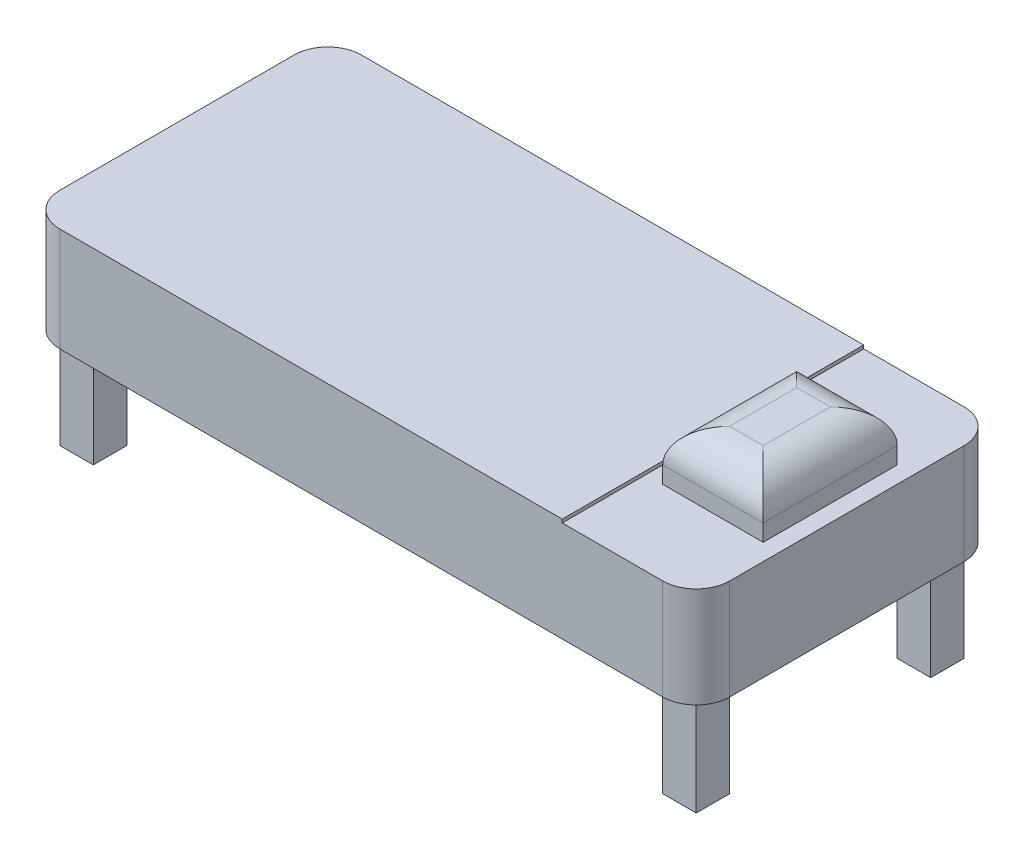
SolidWorks part; units mm, degrees
ref_plane "Plan de face" through (0, 0, 0) normal (0, 0, 1) x (1, 0, 0)
ref_plane "Plan de dessus" through (0, 0, 0) normal (0, 1, 0) x (1, 0, 0)
ref_plane "Plan de droite" through (0, 0, 0) normal (1, 0, 0) x (0, 0, -1)
sketch "Esquisse1" plane through (0, 0, 0) normal (0, 1, 0) x (1, 0, 0)
  line L1 (1000, -450) -> (-1000, -450)
  line L2 (1000, -450) -> (1000, 450)
  line L3 (1000, 450) -> (-1000, 450)
  line L4 (-1000, -450) -> (-1000, 450)
  line L5 (1000, -450) -> (-1000, 450) construction
  line L6 (1000, 450) -> (-1000, -450) construction
  point P0 (0, 0)
  dimension "D1" = 2000
  dimension "D2" = 900
extrude "Boss.-Extru.1" add sketch "Esquisse1" along normal blind 300
sketch "Esquisse2" plane through (0, 0, 0) normal (0, -1, 0) x (1, 0, 0)
  line L0 (-1000, 450) -> (1000, 450) construction
  line L1 (-950, 400) -> (-850, 400)
  line L2 (-950, 400) -> (-950, 300)
  line L3 (-950, 300) -> (-850, 300)
  line L4 (-850, 400) -> (-850, 300)
  line L5 (-950, 400) -> (-850, 300) construction
  line L6 (-950, 300) -> (-850, 400) construction
  line L7 (-1000, -450) -> (-1000, 450) construction
  point P0 (-900, 350)
  dimension "D1" = 100
  dimension "D2" = 100
  dimension "D3" = 50
  dimension "D4" = 50
extrude "Boss.-Extru.2" add sketch "Esquisse2" along normal blind 300
mirror "Symétrie1" about plane through (0, 0, 0) normal (0, 0, 1) of "Boss.-Extru.2"
mirror "Symétrie2" about plane through (0, 0, 0) normal (1, 0, 0) of "Symétrie1", "Boss.-Extru.2"
sketch "Esquisse3" plane through (0, 300, 0) normal (0, 1, 0) x (1, 0, 0)
  line L0 (-1000, -450) -> (1000, -450) construction
  line L1 (-1000, 450) -> (600, 450)
  line L2 (-1000, 450) -> (-1000, -450)
  line L3 (-1000, -450) -> (600, -450)
  line L4 (600, 450) -> (600, -450)
  dimension "D1" = 1600
extrude "Boss.-Extru.3" add sketch "Esquisse3" along normal blind 10
sketch "Esquisse4" plane through (0, 300, 0) normal (0, 1, 0) x (1, 0, 0)
  line L0 (1000, -450) -> (1000, 450) construction
  line L1 (650, 200) -> (950, 200)
  line L2 (650, 200) -> (650, -200)
  line L3 (650, -200) -> (950, -200)
  line L4 (950, 200) -> (950, -200)
  line L10 (1000, 450) -> (600, 450) construction
  dimension "D1" = 400
  dimension "D4" = 300
  dimension "D5" = 50
  dimension "D8" = 250
extrude "Boss.-Extru.4" add sketch "Esquisse4" along normal blind 150
fillet "Congé2" radius 100 4 edges at (800, 450, -200) (950, 450, 0) (800, 450, 200) (650, 450, 0)
fillet "Congé3" radius 100 4 edges at (1000, 150, -450) (1000, 150, 450) (-1000, 155, 450) (-1000, 155, -450)
